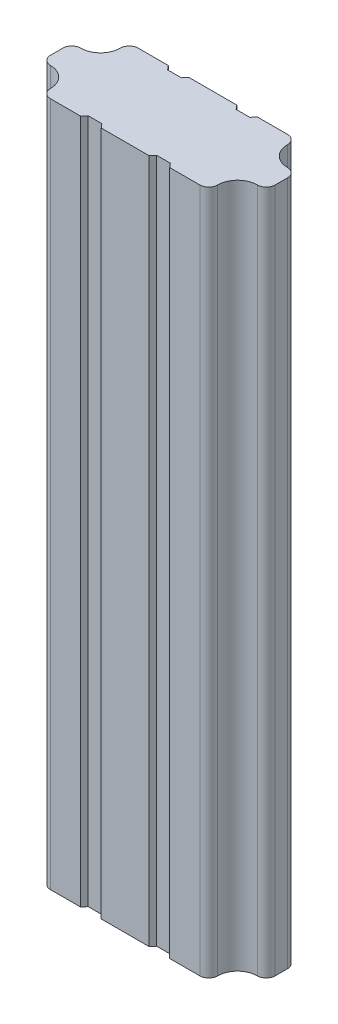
SolidWorks part; units mm, degrees
ref_plane "Alzado" through (0, 0, 0) normal (0, 0, 1) x (1, 0, 0)
ref_plane "Planta" through (0, 0, 0) normal (0, 1, 0) x (1, 0, 0)
ref_plane "Vista lateral" through (0, 0, 0) normal (1, 0, 0) x (0, 0, -1)
sketch "Croquis2" plane through (0, 0, 0) normal (0, 1, 0) x (1, 0, 0)
  line L0 (-183.2758, 0) -> (156.0252, 0) construction
  line L1 (0, 113.0945) -> (0, -113.0945) construction
  line L2 (90, -15.8204) -> (90, 15.8204)
  line L3 (75.5, 40) -> (-75.5, 40)
  line L4 (-17.4827, 32) -> (17.4827, 32)
  line L5 (20, 29) -> (30, 29)
  line L6 (123.5786, 25.5) -> (27.4214, 25.5) construction
  line L7 (75.5, 71.4027) -> (75.5, -20.4027) construction
  line L8 (82, 4.5) -> (82, -4.5)
  line L9 (20, 29) -> (17.4827, 32)
  line L10 (30, 29) -> (32.5173, 32)
  line L11 (32.5173, 32) -> (54.5, 32)
  line L12 (75.5, -71.4027) -> (75.5, 20.4027) construction
  line L13 (123.5786, -25.5) -> (27.4214, -25.5) construction
  line L14 (32.5173, -32) -> (54.5, -32)
  line L15 (30, -29) -> (32.5173, -32)
  line L16 (20, -29) -> (17.4827, -32)
  line L17 (20, -29) -> (30, -29)
  line L18 (-17.4827, -32) -> (17.4827, -32)
  line L19 (75.5, -40) -> (-75.5, -40)
  line L20 (-123.5786, -25.5) -> (-27.4214, -25.5) construction
  line L21 (-75.5, -71.4027) -> (-75.5, 20.4027) construction
  line L22 (-75.5, 71.4027) -> (-75.5, -20.4027) construction
  line L23 (-123.5786, 25.5) -> (-27.4214, 25.5) construction
  line L24 (-20, -29) -> (-30, -29)
  line L25 (-20, -29) -> (-17.4827, -32)
  line L26 (-30, -29) -> (-32.5173, -32)
  line L27 (-32.5173, -32) -> (-54.5, -32)
  line L28 (-32.5173, 32) -> (-54.5, 32)
  line L29 (-30, 29) -> (-32.5173, 32)
  line L30 (-20, 29) -> (-17.4827, 32)
  line L31 (-82, 4.5) -> (-82, -4.5)
  line L32 (-20, 29) -> (-30, 29)
  line L33 (-90, -15.8204) -> (-90, 15.8204)
  arc A0 (88.1963, 32.5039) -> (75.5, 40) centre (75.5, 25.5) ccw
  arc A1 (81.1914, 28.6397) -> (79.722, 20.5579) centre (75.5, 25.5) ccw
  arc A3 (61, 25.5) -> (54.5, 32) centre (54.5, 25.5) ccw
  arc A4 (81.1914, 28.6397) -> (88.1963, 32.5039) centre (84.6939, 30.5718) ccw
  arc A5 (90, 15.8204) -> (79.722, 20.5579) centre (83.7692, 15.8204) ccw
  arc A6 (82, 4.5) -> (75.5, 11) centre (75.5, 4.5) ccw
  arc A7 (61, 25.5) -> (75.5, 11) centre (75.5, 25.5) ccw
  arc A8 (61, -25.5) -> (75.5, -11) centre (75.5, -25.5) cw
  arc A9 (82, -4.5) -> (75.5, -11) centre (75.5, -4.5) cw
  arc A10 (90, -15.8204) -> (79.722, -20.5579) centre (83.7692, -15.8204) cw
  arc A11 (81.1914, -28.6397) -> (88.1963, -32.5039) centre (84.6939, -30.5718) cw
  arc A12 (61, -25.5) -> (54.5, -32) centre (54.5, -25.5) cw
  arc A13 (81.1914, -28.6397) -> (79.722, -20.5579) centre (75.5, -25.5) cw
  arc A14 (88.1963, -32.5039) -> (75.5, -40) centre (75.5, -25.5) cw
  arc A15 (-88.1963, -32.5039) -> (-75.5, -40) centre (-75.5, -25.5) ccw
  arc A16 (-81.1914, -28.6397) -> (-79.722, -20.5579) centre (-75.5, -25.5) ccw
  arc A17 (-61, -25.5) -> (-54.5, -32) centre (-54.5, -25.5) ccw
  arc A18 (-81.1914, -28.6397) -> (-88.1963, -32.5039) centre (-84.6939, -30.5718) ccw
  arc A19 (-90, -15.8204) -> (-79.722, -20.5579) centre (-83.7692, -15.8204) ccw
  arc A20 (-82, -4.5) -> (-75.5, -11) centre (-75.5, -4.5) ccw
  arc A21 (-61, -25.5) -> (-75.5, -11) centre (-75.5, -25.5) ccw
  arc A22 (-61, 25.5) -> (-75.5, 11) centre (-75.5, 25.5) cw
  arc A23 (-82, 4.5) -> (-75.5, 11) centre (-75.5, 4.5) cw
  arc A24 (-90, 15.8204) -> (-79.722, 20.5579) centre (-83.7692, 15.8204) cw
  arc A25 (-81.1914, 28.6397) -> (-88.1963, 32.5039) centre (-84.6939, 30.5718) cw
  arc A26 (-61, 25.5) -> (-54.5, 32) centre (-54.5, 25.5) cw
  arc A27 (-81.1914, 28.6397) -> (-79.722, 20.5579) centre (-75.5, 25.5) cw
  arc A28 (-88.1963, 32.5039) -> (-75.5, 40) centre (-75.5, 25.5) cw
  point P6 (0, 0)
  point P8 (-90, 0)
  point P9 (0, 40)
  point P17 (75.5, 25.5)
  point P20 (75.5, 25.5)
  point P56 (82, 0)
  point P58 (90, 0)
  point P94 (0, -40)
  point P95 (0, -32)
  point P102 (0, 32)
  point P103 (-82, 0)
  dimension "D5" = 14.5
  dimension "D6" = 6.5
  dimension "D7" = 6.2308
  dimension "D8" = 9.1939
  dimension "D1" = 90
  dimension "D2" = 40
  dimension "D3" = 8
  dimension "D4" = 8
  dimension "D9" = 21
  dimension "D10" = 10
  dimension "D11" = 20
  dimension "D12" = 3
  dimension "D13" = 50
  dimension "D14" = 50
extrude "Saliente-Extruir1" add sketch "Croquis2" along normal blind 500 contours A26 A22 A23 L31 A20 A21 A17 L27 L26 L24 L25 L18 L16 L17 L15 L14 A12 A8 A9 L8 A6 A7 A3 L11 L10 L5 L9 L4 L30 L32 L29 L28
